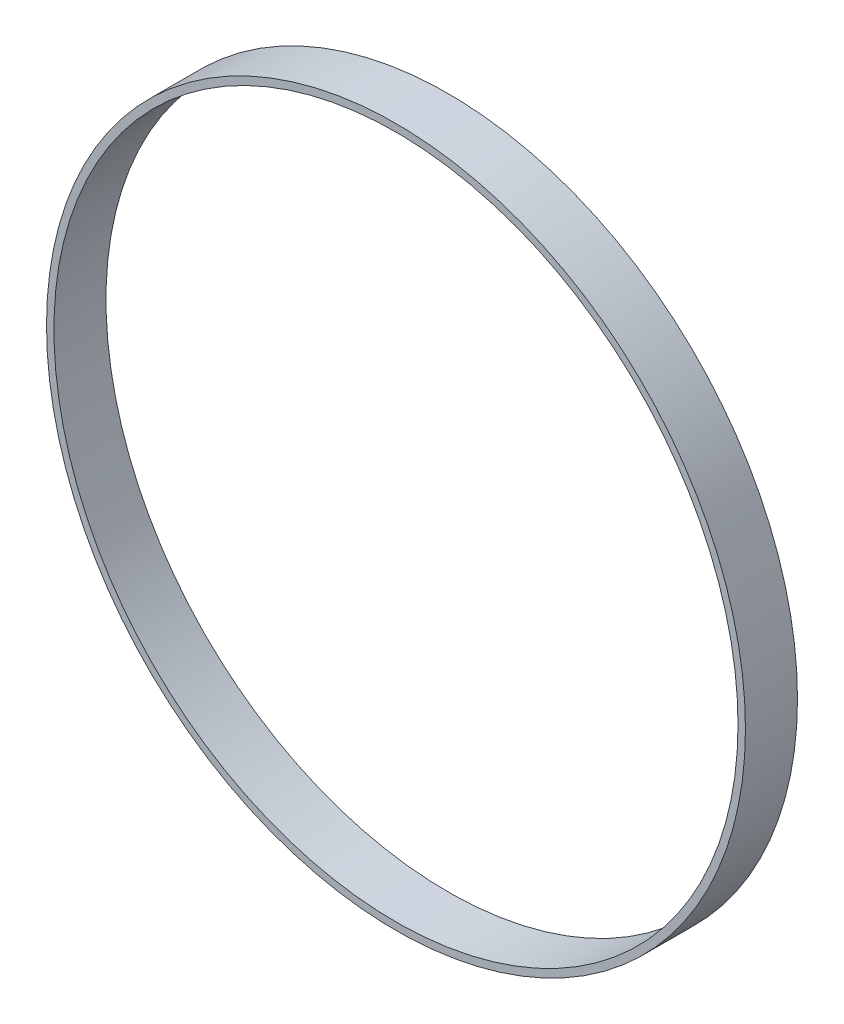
SolidWorks part; units mm, degrees
ref_plane "Plan de face" through (0, 0, 0) normal (0, 0, 1) x (1, 0, 0)
ref_plane "Plan de dessus" through (0, 0, 0) normal (0, 1, 0) x (1, 0, 0)
ref_plane "Plan de droite" through (0, 0, 0) normal (1, 0, 0) x (0, 0, -1)
sketch "Esquisse1" plane through (0, 0, 0) normal (0, 0, 1) x (1, 0, 0)
  circle A0 centre (0, 0) radius 47
  circle A1 centre (0, 0) radius 46
  dimension "D1" = 92
  dimension "D2" = 94
extrude "Extrusion1" add sketch "Esquisse1" along normal blind 7
